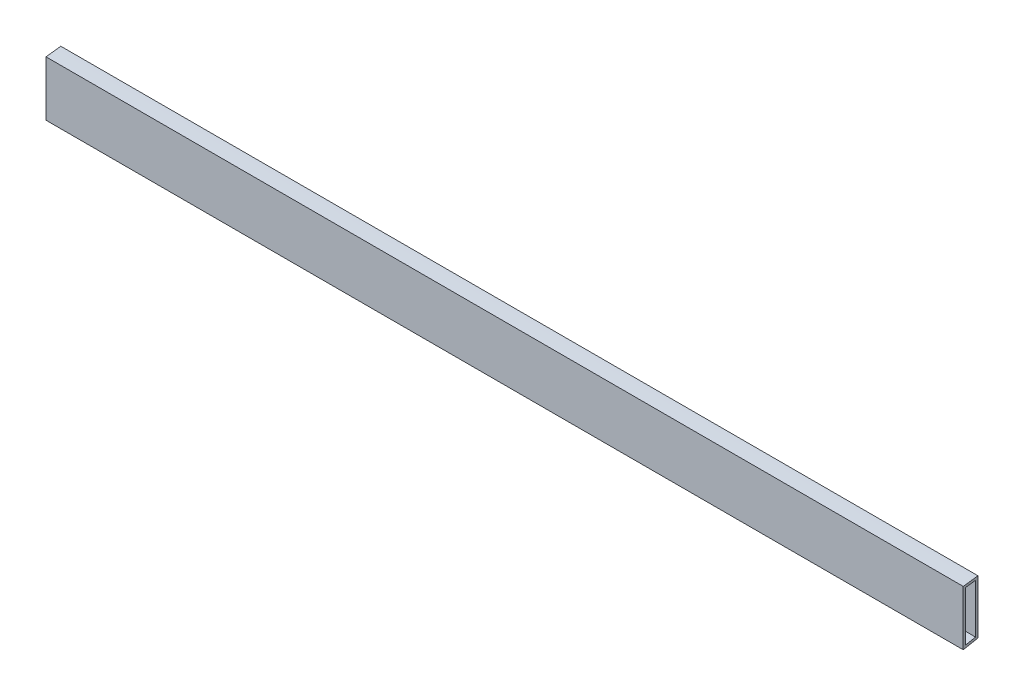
SolidWorks part; units mm, degrees
ref_plane "Front Plane" through (0, 0, 0) normal (0, 0, 1) x (1, 0, 0)
ref_plane "Top Plane" through (0, 0, 0) normal (0, 1, 0) x (1, 0, 0)
ref_plane "Right Plane" through (0, 0, 0) normal (1, 0, 0) x (0, 0, -1)
curve "Curve1"
sketch "Sketch1" plane through (0, 0, 0) normal (1, 0, 0) x (0, 0, -1)
  line L0 (32.5438, 18.2236) -> (32.5438, 2.1862)
  line L1 (0, 0) -> (0, 95.7684) construction
  line L2 (31.75, 18.9087) -> (31.75, 1.2273)
  line L3 (36.5125, 19.4825) -> (36.5125, 2.1283)
  line L4 (35.7188, 18.6104) -> (35.7187, 2.7868)
  spline S0 degree 1 poles (32.5438, 2.1862) (35.7187, 2.7868) knots 0 0 1 1 construction
  spline S1 degree 3 poles (36.5125, 19.4825) (35.3153, 19.3767) (33.7258, 19.1971) (32.1428, 18.9686) (31.75, 18.9087) knots 0.367832 0.367832 0.367832 0.367832 0.379616 0.383512 0.383512 0.383512 0.383512
  spline S2 degree 3 poles (31.75, 1.2273) (32.7736, 1.4221) (34.3609, 1.7235) (35.9486, 2.0225) (36.5125, 2.1283) knots 0.620227 0.620227 0.620227 0.620227 0.630444 0.636069 0.636069 0.636069 0.636069
  spline S3 degree 1 poles (35.7188, 18.6104) (32.5438, 18.2236) knots 0 0 1 1 construction
  spline S4 degree 3 poles (32.5438, 2.1862) (33.6019, 2.3872) (34.6602, 2.5877) (35.7187, 2.7868) knots 0.623361 0.623361 0.623361 0.623361 0.633917 0.633917 0.633917 0.633917
  spline S5 degree 3 poles (35.7188, 18.6104) (34.6579, 18.504) (33.5991, 18.3748) (32.5438, 18.2236) knots 0.370698 0.370698 0.370698 0.370698 0.381261 0.381261 0.381261 0.381261
  dimension "D1" = 0.7937
  dimension "D2" = 31.75
  dimension "D3" = 36.5125
extrude "Boss-Extrude1" add sketch "Sketch1" along normal blind 295.275
